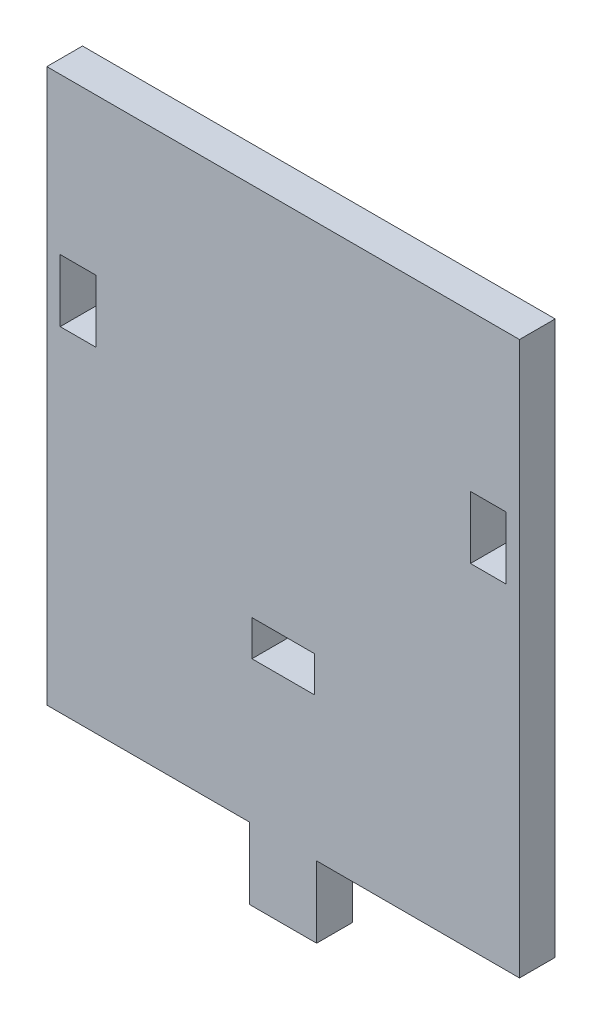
SolidWorks part; units mm, degrees
ref_plane "Front Plane" through (0, 0, 0) normal (0, 0, 1) x (1, 0, 0)
ref_plane "Top Plane" through (0, 0, 0) normal (0, 1, 0) x (1, 0, 0)
ref_plane "Right Plane" through (0, 0, 0) normal (1, 0, 0) x (0, 0, -1)
sketch "Sketch1" plane through (0, 0, 0) normal (0, 0, 1) x (1, 0, 0)
  line L0 (16.9511, -10.8647) -> (20.9511, -10.8647)
  line L1 (-30.5489, 6.6353) -> (22.4511, 6.6353)
  line L2 (-30.5489, 6.6353) -> (-30.5489, -55.3647)
  line L3 (-30.5489, -55.3647) -> (-7.7989, -55.3647)
  line L4 (22.4511, 6.6353) -> (22.4511, -55.3647)
  line L5 (-30.5489, 6.6353) -> (22.4511, -55.3647) construction
  line L6 (-30.5489, -55.3647) -> (22.4511, 6.6353) construction
  line L8 (-7.7989, -55.3647) -> (-7.7989, -63.3647)
  line L9 (-7.7989, -63.3647) -> (-0.2989, -63.3647)
  line L10 (-0.2989, -55.3647) -> (-0.2989, -63.3647)
  line L13 (-7.5489, -35.3647) -> (-0.5489, -35.3647)
  line L14 (-7.5489, -35.3647) -> (-7.5489, -39.3647)
  line L15 (-7.5489, -39.3647) -> (-0.5489, -39.3647)
  line L16 (-0.5489, -35.3647) -> (-0.5489, -39.3647)
  line L19 (-29.0489, -10.8647) -> (-25.0489, -10.8647)
  line L20 (-29.0489, -10.8647) -> (-29.0489, -17.8647)
  line L21 (-29.0489, -17.8647) -> (-25.0489, -17.8647)
  line L22 (-25.0489, -10.8647) -> (-25.0489, -17.8647)
  line L25 (16.9511, -10.8647) -> (16.9511, -17.8647)
  line L26 (16.9511, -17.8647) -> (20.9511, -17.8647)
  line L27 (20.9511, -10.8647) -> (20.9511, -17.8647)
  line L30 (-0.2989, -55.3647) -> (22.4511, -55.3647)
  point P0 (-4.0489, -24.3647)
  point P5 (-4.0489, -59.3647)
  point P11 (-27.0489, -10.8647)
  point P12 (-4.0489, -37.3647)
  point P19 (-27.0489, -14.3457)
  point P26 (18.9511, -14.3457)
  point P32 (-4.0489, -35.3647)
  dimension "D1" = 53
  dimension "D2" = 62
  dimension "D3" = 1.5
  dimension "D4" = 17.5
  dimension "D5" = 17.5
  dimension "D7" = 4.0489
extrude "Boss-Extrude3" add sketch "Sketch1" along normal blind 4 contours L10 L30 L4 L1 L2 L3 L8 L9 L0 L27 L26 L25 L19 L22 L21 L20 L13 L16 L15 L14
